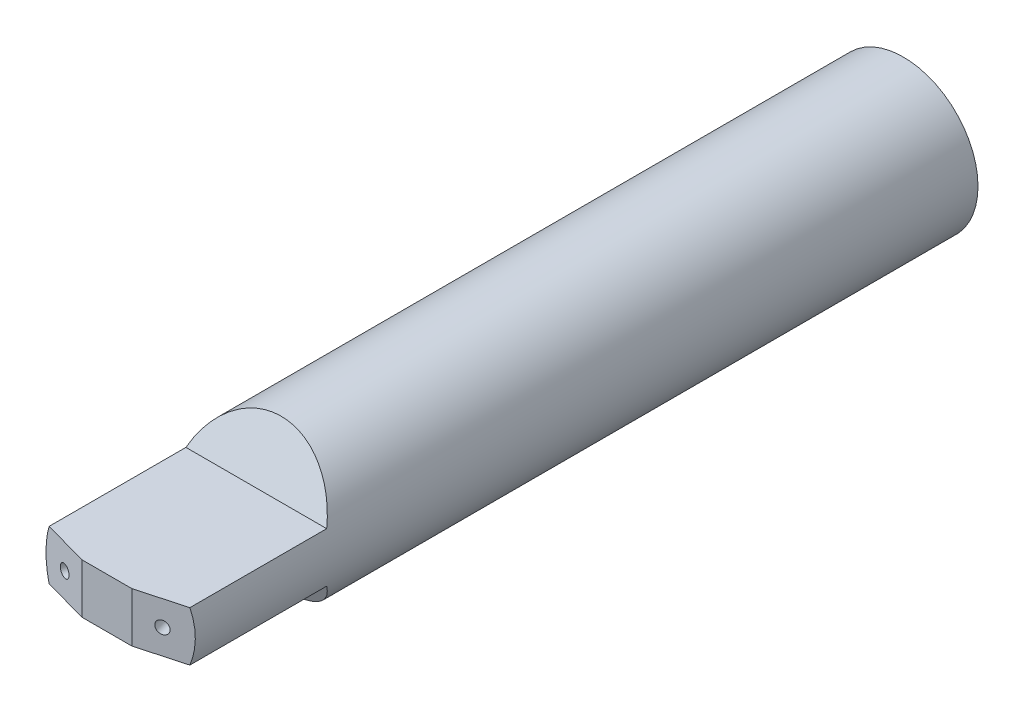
SolidWorks part; units mm, degrees
ref_plane "Plan de face" through (0, 0, 0) normal (0, 0, 1) x (1, 0, 0)
ref_plane "Plan de dessus" through (0, 0, 0) normal (0, 1, 0) x (1, 0, 0)
ref_plane "Plan de droite" through (0, 0, 0) normal (1, 0, 0) x (0, 0, -1)
sketch "Esquisse1" plane through (0, 0, 0) normal (0, 0, 1) x (1, 0, 0)
  circle A0 centre (0, 0) radius 3
extrude "Extrusion1" add sketch "Esquisse1" along normal blind 32
sketch "Esquisse2" plane through (0, 0, 0) normal (1, 0, 0) x (0, 0, -1)
  line L0 (-32, 3) -> (-32, -3) construction
  line L1 (-32, 3) -> (-26, 3)
  line L2 (-32, 3) -> (-32, 1)
  line L3 (-32, 1) -> (-26, 1)
  line L5 (-26, 1) -> (-25, 3)
  line L6 (-32, -3) -> (-26, -3)
  line L7 (-32, -3) -> (-32, -1)
  line L8 (-32, -1) -> (-26, -1)
  line L10 (0, 3) -> (-32, 3) construction
  line L11 (-25, 3) -> (-26, 3)
  line L12 (-26, -1) -> (-25, -3)
  line L13 (-32, -3) -> (0, -3) construction
  line L14 (-25, -3) -> (-26, -3)
  dimension "D1" = 6
  dimension "D2" = 2
  dimension "D3" = 2
  dimension "D4" = 1
extrude "Enlèv. mat.-Extru.1" cut sketch "Esquisse2" against normal through all and the other way through all
sketch "Esquisse3" plane through (0, 0, 0) normal (0, 1, 0) x (1, 0, 0)
  line L0 (1, -32) -> (3, -31.45)
  line L1 (-2.8284, -32) -> (2.8284, -32) construction
  line L2 (3, -32) -> (3, 0) construction
  line L3 (1, -32) -> (1, -32.4283)
  line L4 (1, -32.4283) -> (-1, -32.4283)
  line L5 (-1, -32.4283) -> (-1, -32)
  line L6 (-1, -32) -> (-3, -31.45)
  line L7 (-3, 0) -> (-3, -32) construction
  line L8 (-3, -31.45) -> (-3.4422, -31.45)
  line L9 (-3.4422, -31.45) -> (-3.4422, -32.8845)
  line L10 (-3.4422, -32.8845) -> (3.3071, -32.8845)
  line L11 (3.3071, -32.8845) -> (3.3071, -31.45)
  line L12 (3.3071, -31.45) -> (3, -31.45)
  dimension "D1" = 2
  dimension "D2" = 0.55
  dimension "D3" = 2
  dimension "D4" = 0.55
extrude "Enlèv. mat.-Extru.2" cut sketch "Esquisse3" against normal through all and the other way through all
sketch "Esquisse4" plane through (-8.2516, 0, 30.0058) normal (-0.2652, 0, 0.9642) x (0.9642, 0, 0.2652)
  line L0 (7.5208, -1) -> (7.5208, 1) construction
  circle A0 centre (6.5208, 0) radius 0.25
  dimension "D1" = 1
extrude "Enlèv. mat.-Extru.3" cut sketch "Esquisse4" against normal blind 5
sketch "Esquisse5" plane through (8.2516, 0, 30.0058) normal (0.2652, 0, 0.9642) x (0.9642, 0, -0.2652)
  line L0 (-7.5208, -1) -> (-7.5208, 1) construction
  circle A0 centre (-6.5208, 0) radius 0.25
  dimension "D1" = 1
extrude "Enlèv. mat.-Extru.4" cut sketch "Esquisse5" against normal blind 5
